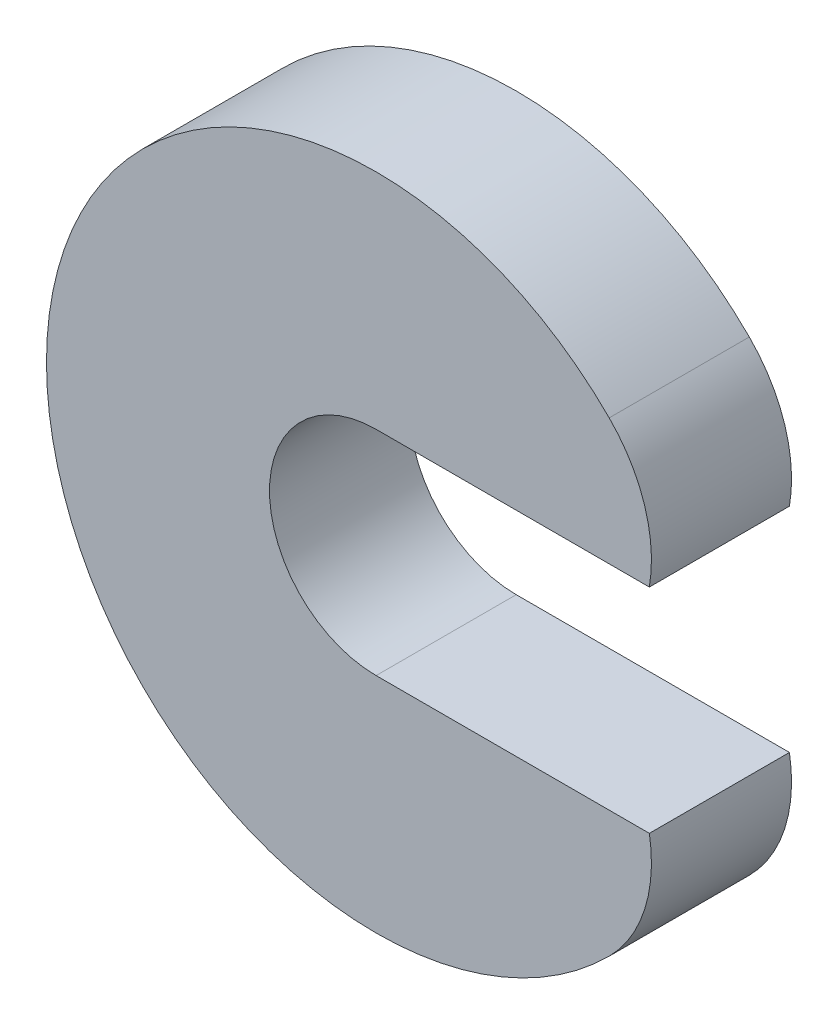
SolidWorks part; units mm, degrees
ref_plane "前视基准面" through (0, 0, 0) normal (0, 0, 1) x (1, 0, 0)
ref_plane "上视基准面" through (0, 0, 0) normal (0, 1, 0) x (1, 0, 0)
ref_plane "右视基准面" through (0, 0, 0) normal (1, 0, 0) x (0, 0, -1)
sketch "草图1" plane through (0, 0, 0) normal (0, 0, 1) x (1, 0, 0)
  line L0 (0, 0) -> (282.8427, 282.8427) construction
  line L1 (0, 0) -> (282.8427, -282.8427) construction
  line L2 (0, 0) -> (-610.8096, 0) construction
  line L3 (0, -129.39) -> (310, -129.39)
  line L5 (310, 129.39) -> (0, 129.39)
  line L7 (310, 129.39) -> (331.5588, 129.39)
  line L8 (310, -129.39) -> (331.5588, -129.39)
  arc A0 (282.8427, 282.8427) -> (282.8427, -282.8427) centre (0, 0) ccw
  arc A3 (0, 129.39) -> (0, -129.39) centre (0, 0) ccw
  arc A4 (282.8427, 282.8427) -> (331.5588, 129.39) centre (159.099, 159.099) cw
  arc A5 (282.8427, -282.8427) -> (331.5588, -129.39) centre (159.099, -159.099) ccw
  dimension "D1" = 400
  dimension "D2" = 175
  dimension "D3" = 135
  dimension "D4" = 135
  dimension "D5" = 310
  dimension "D6" = 175
extrude "凸台-拉伸1" add sketch "草图1" along normal blind 170
